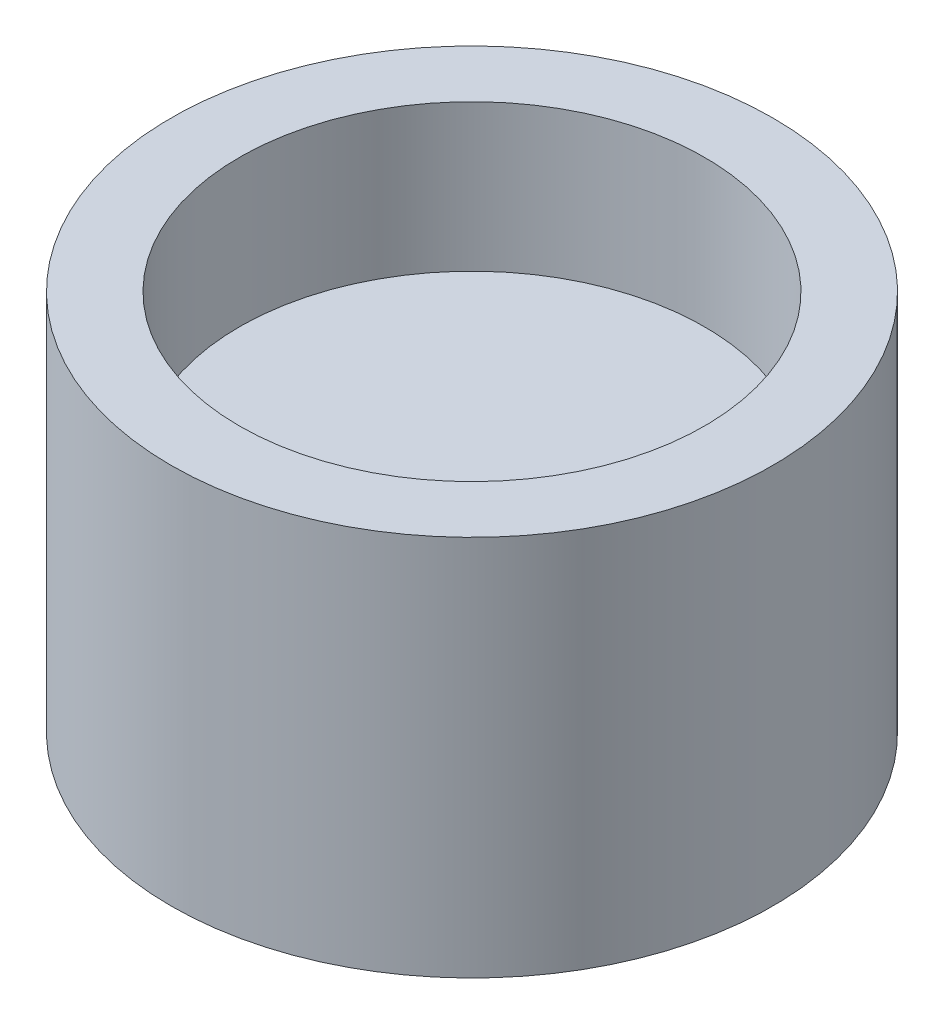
SolidWorks part; units mm, degrees
ref_plane "Front" through (0, 0, 0) normal (0, 0, 1) x (1, 0, 0)
ref_plane "Top" through (0, 0, 0) normal (0, 1, 0) x (1, 0, 0)
ref_plane "Right" through (0, 0, 0) normal (1, 0, 0) x (0, 0, -1)
sketch "Sketch1" plane through (0, 0, 0) normal (0, 1, 0) x (1, 0, 0)
  circle A0 centre (0, 0) radius 5.207
  dimension "D1" = 10.414
extrude "Boss-Extrude1" add sketch "Sketch1" along normal blind 6.604
sketch "Sketch2" plane through (0, 6.604, 0) normal (0, 1, 0) x (1, 0, 0)
  circle A0 centre (0, 0) radius 4.0259
  dimension "D1" = 8.0518
extrude "Cut-Extrude1" cut sketch "Sketch2" against normal blind 2.54
sketch "Sketch3" plane through (0, 0, 0) normal (0, -1, 0) x (1, 0, 0)
  circle A0 centre (0, 0) radius 4.7625
  dimension "D1" = 9.525
extrude "Cut-Extrude2" cut sketch "Sketch3" against normal blind 3.175
